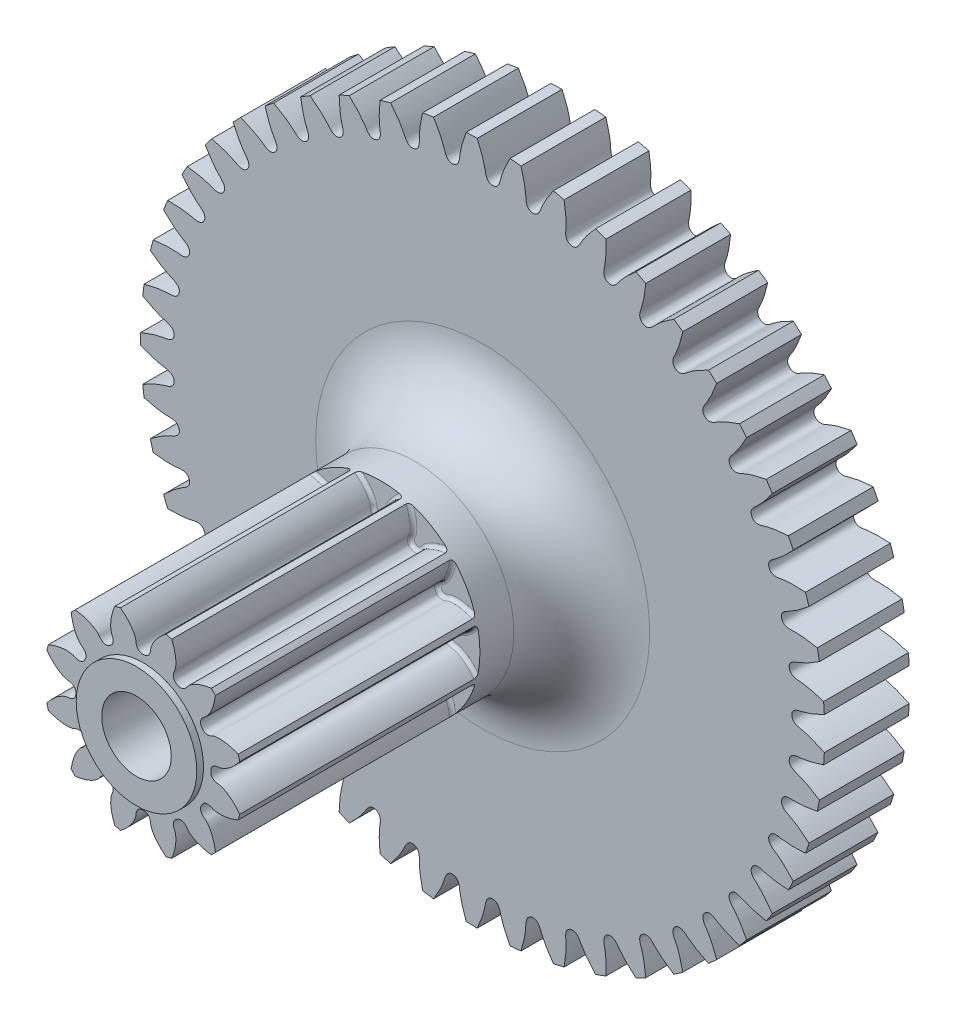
SolidWorks part; units mm, degrees
ref_plane "Front Plane" through (0, 0, 0) normal (0, 0, 1) x (1, 0, 0)
ref_plane "Top Plane" through (0, 0, 0) normal (0, 1, 0) x (1, 0, 0)
ref_plane "Right Plane" through (0, 0, 0) normal (1, 0, 0) x (0, 0, -1)
imported_body "Imported3"
sketch "Sketch1" plane through (0, 0, 11.25) normal (0, 0, 1) x (1, 0, 0)
  circle A0 centre (0, 0) radius 1.7764
extrude "Boss-Extrude1" add sketch "Sketch1" along normal blind 0.2
sketch "Sketch2" plane through (0, 0, 0) normal (0, 1, 0) x (1, 0, 0)
  line L0 (2, 1.55) -> (0, 1.55)
  line L1 (0, 1.55) -> (0, 1.25)
  line L2 (0, 1.25) -> (2, 1.25)
  line L3 (2, 1.25) -> (2, 1.55)
  line L4 (0, 1.55) -> (0, 1.25) construction
revolve "Revolve1" add sketch "Sketch2" angle 360 about L4
hole_wizard "#1 Clearance Hole1" positions "Sketch4" profile "Sketch3" hole size "#1" standard "ANSI Inch"
sketch "Sketch4" plane through (0, 0, 11.45) normal (0, 0, 1) x (1, 0, 0)
  point P0 (0, 0)
sketch "Sketch3" plane through (0, 0, 11.45) normal (1, 0, 0) x (0, -1, 0)
  line L0 (0, 0) -> (0, 13)
  line L1 (0, 13) -> (1.025, 13)
  line L2 (1.025, 13) -> (1.025, 0)
  line L5 (1.025, 0) -> (0, 0)
  line L11 (0, -6.35) -> (0, 107.95) construction
  dimension "Thru Hole Dia." = 2.05
  dimension "Thru Hole Depth" = 13
fillet "Fillet1" radius 2 1 edges at (-2.92, 0, 1.25)
